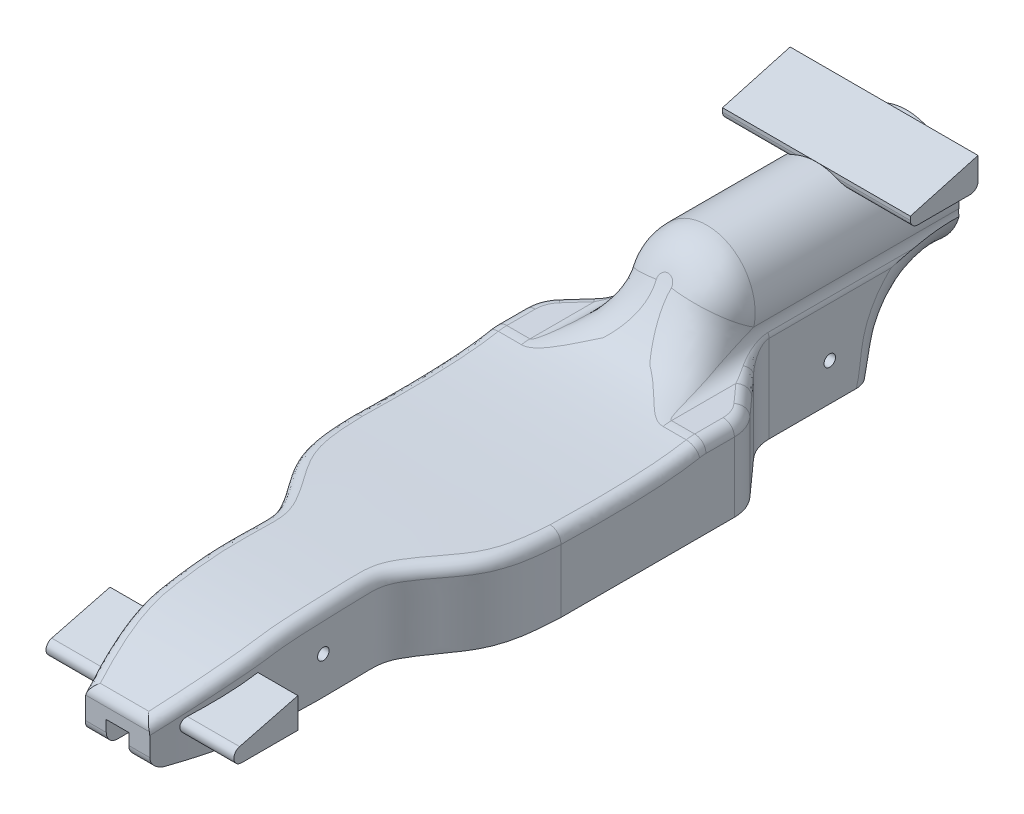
SolidWorks part; units mm, degrees
ref_plane "Front Plane" through (0, 0, 0) normal (0, 0, 1) x (1, 0, 0)
ref_plane "Top Plane" through (0, 0, 0) normal (0, 1, 0) x (1, 0, 0)
ref_plane "Right Plane" through (0, 0, 0) normal (1, 0, 0) x (0, 0, -1)
sketch "Sketch1" plane through (0, 0, 0) normal (0, 0, 1) x (1, 0, 0)
  line L1 (-32.5, 0) -> (32.5, 0)
  line L2 (-32.5, 0) -> (-32.5, 50)
  line L3 (-32.5, 50) -> (32.5, 50)
  line L4 (32.5, 0) -> (32.5, 50)
  dimension "D1" = 65
  dimension "D2" = 50
extrude "Balsa Block" add sketch "Sketch1" along normal blind 223
sketch "Sketch2" plane through (0, 0, 223) normal (0, 0, 1) x (1, 0, 0)
  line L0 (-32.5, 0) -> (32.5, 0) construction
  line L1 (-3, 0) -> (3, 0)
  line L2 (-3, 0) -> (-3, 6)
  line L3 (-3, 6) -> (3, 6)
  line L4 (3, 0) -> (3, 6)
  dimension "D1" = 6
  dimension "D2" = 6
extrude "Screw Eye Slot" cut sketch "Sketch2" against normal through all
sketch "Sketch3" plane through (0, 0, 0) normal (0, 0, -1) x (-1, 0, 0)
  line L0 (32.5, 0) -> (3, 0) construction
  circle A0 centre (0, 29) radius 9.55
  dimension "D1" = 19.1
  dimension "D2" = 29
extrude "CO2 Cartridge Hole" cut sketch "Sketch3" against normal blind 52
sketch "Sketch4" plane through (32.5, 0, 0) normal (1, 0, 0) x (0, 0, -1)
  line L0 (-223, 0) -> (0, 0) construction
  line L1 (0, 0) -> (0, 50) construction
  circle A0 centre (-170, 10) radius 1.525
  circle A1 centre (-35, 10) radius 1.525
  dimension "D4" = 3.05
  dimension "D1" = 10
  dimension "D2" = 135
  dimension "D3" = 35
extrude "Axle Hole Cut Out" cut sketch "Sketch4" against normal through all
sketch "Sketch5" plane through (0, 50, 0) normal (0, 1, 0) x (1, 0, 0)
  line L0 (32.5, 0) -> (-32.5, 0) construction
  line L1 (0, 0) -> (0, -229.7898) construction
  line L2 (-14.55, 0) -> (-14.55, -51.1732)
  line L3 (-17.1047, -57.8491) -> (-25.4453, -67.1509)
  line L4 (-28, -73.8268) -> (-28, -120)
  line L5 (-14.4879, 48.8908) -> (-14.4879, 49.7327) construction
  line L6 (28, -73.8268) -> (28, -120)
  line L7 (17.1047, -57.8491) -> (25.4453, -67.1509)
  line L8 (14.55, 0) -> (14.55, -51.1732)
  line L9 (-14.7766, 49.831) -> (-14.7766, 50.2789) construction
  line L10 (-9.55, 0) -> (-9.55, -52) construction
  line L11 (9.55, -52) -> (9.55, 0) construction
  arc A0 (-25.4453, -67.1509) -> (-28, -73.8268) centre (-18, -73.8268) ccw
  arc A1 (-14.55, -51.1732) -> (-17.1047, -57.8491) centre (-24.55, -51.1732) cw
  arc A2 (14.55, -51.1732) -> (17.1047, -57.8491) centre (24.55, -51.1732) ccw
  arc A3 (25.4453, -67.1509) -> (28, -73.8268) centre (18, -73.8268) cw
  spline S0 degree 3 poles (-28, -120) (-27.6859, -126.0056) (-27.1636, -135.9946) (-19.7034, -144.9636) (-13.3488, -154.8578) (-14.7766, -154.2092) (-14.7766, -173.3072) (-14.4879, -181.2754) (-14.4879, -195.7718) (-8.4397, -210.8954) (-2.3915, -226.019) knots 0 0 0 0 0.179945 0.299298 0.299298 0.625194 0.625194 0.690626 0.690626 1 1 1 1
  spline S1 degree 3 poles (28, -120) (27.6859, -126.0056) (27.1636, -135.9946) (19.7034, -144.9636) (13.3488, -154.8578) (14.7766, -154.2092) (14.7766, -173.3072) (14.4879, -181.2754) (14.4879, -195.7718) (8.4397, -210.8954) (2.3915, -226.019) knots 0 0 0 0 0.179945 0.299298 0.299298 0.625194 0.625194 0.690626 0.690626 1 1 1 1
  spline S2 degree 3 poles (-14.55, 0) (-14.55, -18.3333) (-14.55, -36.6667) (-14.55, -55) knots 0 0 0 0 1 1 1 1
  spline S3 degree 3 poles (14.55, 0) (14.55, -18.3333) (14.55, -36.6667) (14.55, -55) knots 0 0 0 0 1 1 1 1
  dimension "D2" = 5
  dimension "D1" = 5
sketch "Sketch6" plane through (0, 0, 0) normal (1, 0, 0) x (0, 0, -1)
  line L1 (-52, 19.45) -> (0, 19.45) construction
  line L3 (0, 27.5) -> (0, -27.5) construction
  line L10 (-210, 10.9116) -> (-210, 0)
  line L13 (-210, 0) -> (-22.7709, 0)
  spline S0 degree 3 poles (-210, 10.9116) (-202.7227, 13.8598) (-188.783, 19.5071) (-143.7313, 22.444) (-85.5632, 16.1988) (-63.4626, 33.1745) (-61.6089, 55.2214) (-24.8176, 48.2515) (0, 43.55) knots 0 0 0 0 0.060945 0.11674 0.333018 0.333018 0.550088 1 1 1 1
  spline S1 degree 3 poles (-22.7709, 0) (-21.942, 3.2613) (-20.3664, 9.4604) (-11.2641, 16.1435) (-4.1106, 15.068) (0, 14.45) knots 0 0 0 0 0.32075 0.609686 1 1 1 1
  dimension "D3" = 5
  dimension "D1" = 210
  dimension "D2" = 5
sketch "Sketch7" plane through (0, 0, 0) normal (0, 0, -1) x (-1, 0, 0)
  line L0 (18.8348, 21.5) -> (32.5, 21.5)
  line L2 (-18.8348, 21.5) -> (-32.5, 21.5)
  line L5 (0, 0) -> (0, 64.6236) construction
  arc A0 (13.8783, 27.1579) -> (-13.8783, 27.1579) centre (0, 29) ccw
  arc A1 (-13.8783, 27.1579) -> (-18.8348, 21.5) centre (-18.8348, 26.5) cw
  arc A2 (13.8783, 27.1579) -> (18.8348, 21.5) centre (18.8348, 26.5) ccw
  dimension "D1" = 14
  dimension "D3" = 5
  dimension "D2" = 21.5
  dimension "D4" = 65
sketch "Sketch8" plane through (0, 0, 0) normal (1, 0, 0) x (0, 0, -1)
  line L0 (-202.5076, 10) -> (-187, 14)
  line L1 (-187, 14) -> (-187, 6)
  line L2 (-187, 6) -> (-202, 6)
  line L3 (-210, 0) -> (-22.7709, 0) construction
  line L6 (-210, 10.9116) -> (-210, 0) construction
  arc A0 (-202.5076, 10) -> (-202, 6) centre (-202, 8.0322) ccw
  dimension "D1" = 15
  dimension "D2" = 6
  dimension "D3" = 8
  dimension "D4" = 10
  dimension "D5" = 8
extrude "Cut-Extrude1" cut sketch "Sketch5" against normal through all contours S0 L4 A0 L3 A1 L2 M33 M34 M35 | L6 S1 L8 A2 L7 A3 M35 M36 M33
extrude "Cut-Extrude2" cut sketch "Sketch6" against normal through all and the other way through all flip side to cut
extrude "Cut-Extrude3" cut sketch "Sketch7" against normal through all and the other way through all flip side to cut
extrude "Boss-Extrude1" add sketch "Sketch8" along normal mid plane 50
sketch "Sketch9" plane through (0, 0, 0) normal (1, 0, 0) x (0, 0, -1)
  line L0 (-24, 43) -> (-6, 48)
  line L1 (0, 43) -> (-59.8515, 43) construction
  line L2 (-6, 48) -> (-6, 42)
  line L3 (-8, 40) -> (-22, 40)
  line L4 (-24, 42) -> (-24, 43)
  line L5 (0, 27.1579) -> (0, 43) construction
  arc A0 (-6, 42) -> (-8, 40) centre (-8, 42) cw
  arc A1 (-22, 40) -> (-24, 42) centre (-22, 42) cw
  dimension "D1" = 2
  dimension "D2" = 3
  dimension "D3" = 8
  dimension "D4" = 18
  dimension "D5" = 6
extrude "Boss-Extrude2" add sketch "Sketch9" along normal mid plane 50
fillet "Fillet1" radius 3 19 edges at (5.7908, 0, 210) (-5.7908, 0, 210) (0, 10.9116, 210) (-28, 21.5, 78.2147) (-22.14, 21.5, 63.4647) (-17.9561, 21.5778, 58.7986) (-14.7762, 23.5797, 53.2883) (-14.55, 23.9231, 25.5866) (-27.3395, 21.5, 70.2528) (-15.33, 20.6441, 152.4527) (14.55, 23.9231, 25.5866) (14.7762, 23.5797, 53.2883) (17.9561, 21.5778, 58.7986) (22.14, 21.5, 63.4647) (27.3395, 21.5, 70.2528) (28, 21.5, 78.2147) (15.33, 20.6441, 152.4527)
fillet "Fillet2" radius 12 7 edges at (-26.8663, 20.8488, 82.5337) (26.8663, 20.8488, 82.5337) (21.9174, 21.5, 82.6025) (17.1807, 21.7815, 81.3793) (-21.9174, 21.5, 82.6025) (-17.3362, 21.7299, 81.5913) (0.0541, 42.9999, 59.8516)
fillet "VarFillet1" radius 15 2 edges
